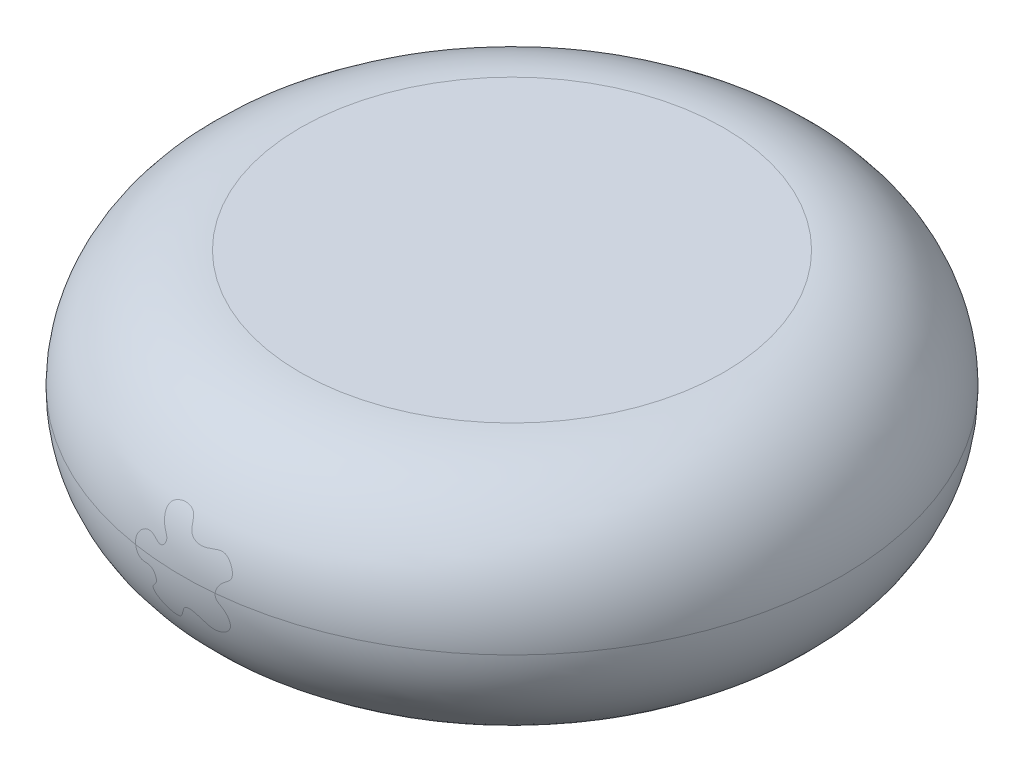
SolidWorks part; units mm, degrees
ref_plane "Front Plane" through (0, 0, 0) normal (0, 0, 1) x (1, 0, 0)
ref_plane "Top Plane" through (0, 0, 0) normal (0, 1, 0) x (1, 0, 0)
ref_plane "Right Plane" through (0, 0, 0) normal (1, 0, 0) x (0, 0, -1)
sketch "Sketch1" plane through (0, 0, 0) normal (0, 0, 1) x (1, 0, 0)
  line L0 (0, 0) -> (0, 26.8474) construction
  line L1 (22.5, 12.5) -> (0, 12.5)
  line L2 (0, 12.5) -> (0, -12.5)
  line L3 (0, -12.5) -> (22.5, -12.5)
  arc A0 (22.5, -12.5) -> (22.5, 12.5) centre (22.5, 0) ccw
  dimension "D1" = 25
  dimension "D2" = 70
revolve "Revolve1" add sketch "Sketch1" angle 360 about L0
sketch "Sketch2" plane through (0, 0, 0) normal (0, 0, 1) x (1, 0, 0)
  line L0 (-35, 0) -> (35, 0)
  arc A0 (-22.5, 12.5) -> (-22.5, -12.5) centre (-22.5, 0) ccw construction
  arc A1 (22.5, -12.5) -> (22.5, 12.5) centre (22.5, 0) ccw construction
sketch "Sketch3" plane through (0, 0, 0) normal (0, 0, 1) x (1, 0, 0)
  spline S0 degree 3 poles (0.4509, 5.946) (0.0587, 3.6823) (2.0152, 3.0381) (3.8447, 4.3653) (5.2221, 1.8706) (3.6173, 1.1803) (3.0059, -0.3984) (4.3297, -1.2189) (4.9787, -3.1132) (2.7548, -4.3022) (1.4776, -3.313) (0.0136, -2.6551) (-0.5873, -3.8363) (-1.1312, -5.0754) (-2.9036, -4.6317) (-4.1404, -3.112) (-2.7838, -2.2918) (-3.3695, -0.6435) (-5.0582, -1.3184) (-5.8691, 1.0173) (-3.8048, 2.6965) (-2.5142, 1.197) (-1.7341, 2.2997) (-2.602, 3.3239) (-3.0293, 5.6171) (0.4509, 5.946) (0.0587, 3.6823) (2.0152, 3.0381) knots -0.160686 -0.102451 -0.040261 0 0.034335 0.096415 0.14591 0.174751 0.221394 0.243343 0.291284 0.35066 0.381027 0.422908 0.449296 0.474591 0.52371 0.564636 0.591023 0.625999 0.6571 0.703215 0.76569 0.796011 0.818925 0.839314 0.897549 0.959739 1 1.034335 1.096415 1.14591 only from (0.4151, 3.8414) to (0.4151, 3.8414)
